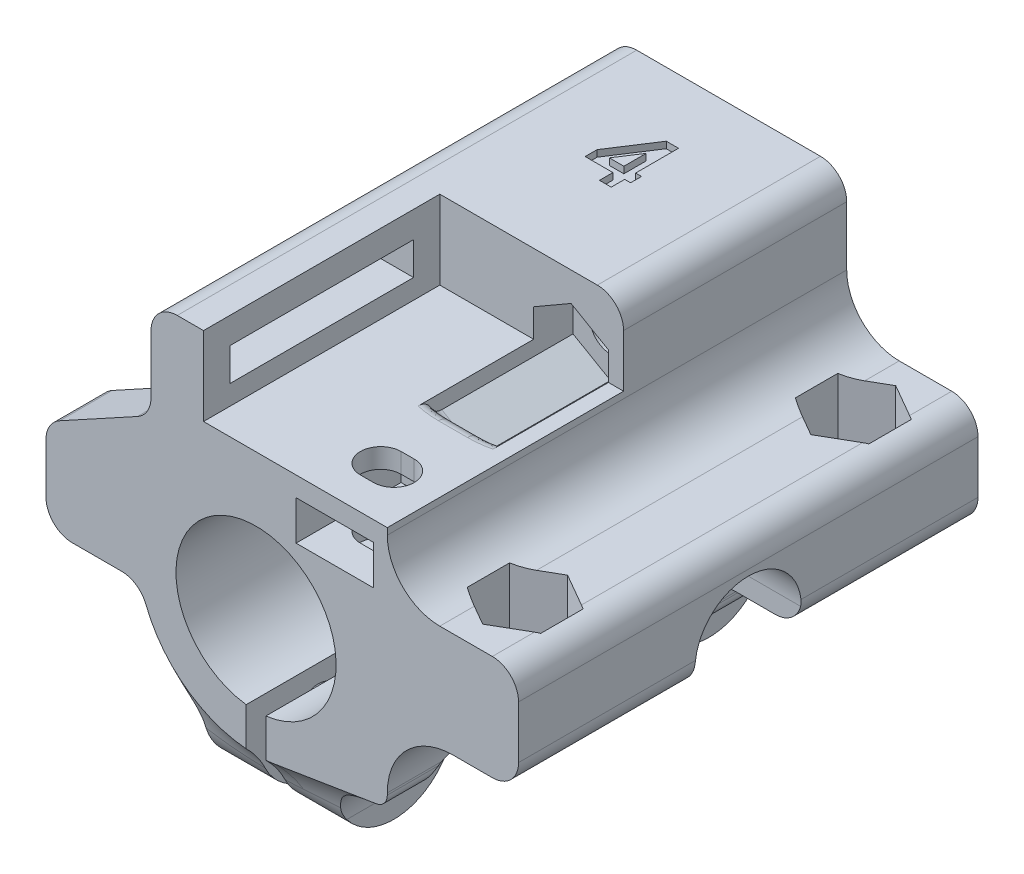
SolidWorks part; units mm, degrees
ref_plane "Спереди" through (0, 0, 0) normal (0, 0, 1) x (1, 0, 0)
ref_plane "Сверху" through (0, 0, 0) normal (0, 1, 0) x (1, 0, 0)
ref_plane "Справа" through (0, 0, 0) normal (1, 0, 0) x (0, 0, -1)
sketch "Эскиз1" plane through (0, 0, 0) normal (0, 0, 1) x (1, 0, 0)
  line L0 (0, 0) -> (0, 21.6321) construction
  line L1 (0, 0) -> (26.3176, 0) construction
  line L2 (10, -1.5) -> (10, -7.5)
  line L3 (-8, 15) -> (-8, 6.0828)
  line L4 (-6, 17) -> (8, 17)
  line L5 (10, 15) -> (10, 6.5)
  line L6 (10, -7.5) -> (1.4365, -8.8846)
  line L8 (10, 6.5) -> (18, 6.5)
  line L9 (20, 4.5) -> (20, 0.5)
  line L10 (18, -1.5) -> (10, -1.5)
  arc A0 (-8.5263, 2.8813) -> (-8, 6.0828) centre (-18, 6.0828) ccw
  arc A1 (-8.5263, 2.8813) -> (1.4365, -8.8846) centre (0, 0) ccw
  arc A2 (20, 0.5) -> (18, -1.5) centre (18, 0.5) cw
  arc A3 (18, 6.5) -> (20, 4.5) centre (18, 4.5) cw
  arc A6 (8, 17) -> (10, 15) centre (8, 15) cw
  arc A7 (-6, 17) -> (-8, 15) centre (-6, 15) ccw
  point P16 (20, 6.5)
  point P30 (20, -1.5)
  dimension "D2" = 1.5
  dimension "D4" = 2
  dimension "D5" = 6
  dimension "D6" = 9
  dimension "D12" = 2
  dimension "D13" = 10
  dimension "D3" = 20
  dimension "D7" = 17
  dimension "D8" = 8
  dimension "D9" = 10
  dimension "D14" = 8
extrude "Бобышка-Вытянуть1" add sketch "Эскиз1" along normal blind 35
fillet "Скругление21" radius 5 1 edges at (10, -1.5, 17.5)
fillet "Скругление24" radius 4 1 edges at (10, 6.5, 17.5)
sketch "Эскиз2" plane through (20, 0, 0) normal (1, 0, 0) x (0, 0, -1)
  line L1 (-35, 0.5) -> (-35, -1.5) construction
  line L3 (-21.55, 0) -> (-21.55, -7.076)
  line L5 (0, 0) -> (-35, 0) construction
  line L8 (-21.55, -7.076) -> (-13.45, -7.076)
  line L9 (-13.45, -7.076) -> (-13.45, 0)
  arc A0 (-13.45, 0) -> (-21.55, 0) centre (-17.5, 0) ccw
  dimension "D1" = 8.1
extrude "Вырез-Вытянуть1" cut sketch "Эскиз2" against normal blind 10
sketch "Эскиз3" plane through (0, 0, 35) normal (0, 0, 1) x (1, 0, 0)
  line L0 (10, 15) -> (10, 11)
  line L3 (10, 11) -> (-4, 11)
  line L4 (-4, 17) -> (-4, 11)
  line L5 (8, 17) -> (-6, 17) construction
  line L6 (-4, 17) -> (8, 17)
  line L7 (10, 10.5) -> (10, 15) construction
  line L10 (0, 0) -> (0, 11.8) construction
  arc A1 (10, 15) -> (8, 17) centre (8, 15) ccw construction
  arc A2 (10, 15) -> (8, 17) centre (8, 15) ccw
  dimension "D1" = 14
  dimension "D3" = 11
extrude "Вырез-Вытянуть2" cut sketch "Эскиз3" against normal blind 18
sketch "Эскиз5" plane through (0, 0, 0) normal (0, 0, -1) x (-1, 0, 0)
  line L0 (0, 0) -> (0, 21.6564) construction
  line L1 (-7.2, 15.7) -> (3.6, 15.7)
  line L2 (-8.2, 14.7) -> (-8.2, 8.3)
  line L3 (-7.2, 7.3) -> (3.6, 7.3)
  line L4 (4.6, 14.7) -> (4.6, 8.3)
  line L6 (-8.2, 11.5) -> (4.6, 11.5) construction
  arc A0 (3.6, 15.7) -> (4.6, 14.7) centre (3.6, 14.7) cw
  arc A1 (3.6, 7.3) -> (4.6, 8.3) centre (3.6, 8.3) ccw
  arc A2 (-8.2, 8.3) -> (-7.2, 7.3) centre (-7.2, 8.3) ccw
  arc A3 (-7.2, 15.7) -> (-8.2, 14.7) centre (-7.2, 14.7) ccw
  point P6 (4.6, 15.7)
  point P13 (-8.2, 15.7)
  dimension "D2" = 1
  dimension "D1" = 12.8
  dimension "D3" = 8.4
  dimension "D4" = 11.5
  dimension "D5" = 8.2
extrude "Вырез-Вытянуть4" cut sketch "Эскиз5" against normal blind 12
fillet "Скругление22" radius 1 1 edges at (10, -7.5, 17.5)
ref_plane "Плоскость2" [suppressed] through (0, 0, 25) normal (0, 0, 1) x (1, 0, 0)
sketch "Эскиз6" plane through (0, 0, 25) normal (0, 0, -1) x (-1, 0, 0)
  line L0 (-7, 11.5) -> (4.6, 11.5) construction
  line L2 (4.6, 8.3) -> (4.6, 14.7) construction
  line L3 (0, 0) -> (0, 20.3496) construction
  circle A0 centre (-6, 11.5) radius 1.55
  dimension "D1" = 3.1
  dimension "D2" = 6
extrude "Вырез-Вытянуть5" cut sketch "Эскиз6" along normal through all
sketch "Эскиз7" plane through (0, 0, 25) normal (0, 0, 1) x (1, 0, 0)
  line L1 (6, 8.2091) -> (8.85, 9.8546)
  line L2 (8.85, 9.8546) -> (8.85, 13.1454)
  line L3 (8.85, 13.1454) -> (6, 14.7909)
  line L4 (6, 14.7909) -> (3.15, 13.1454)
  line L5 (3.15, 13.1454) -> (3.15, 9.8546)
  line L6 (3.15, 9.8546) -> (6, 8.2091)
  circle A0 centre (6, 11.5) radius 2.85 construction
  dimension "D1" = 5.7
extrude "Вырез-Вытянуть6" cut sketch "Эскиз7" against normal blind 11
sketch "Эскиз9" plane through (0, 17, 0) normal (0, 1, 0) x (1, 0, 0)
  line L0 (-6, -17.5) -> (20, -17.5) construction
  line L1 (8, 0) -> (-6, 0) construction
  line L3 (0, 0) -> (0, -35) construction
  line L4 (-4, -35) -> (-6, -35) construction
  circle A0 centre (15.5, -5) radius 1.55
  circle A1 centre (15.5, -30) radius 1.55
  dimension "D1" = 3.1
  dimension "D3" = 15.5
  dimension "D2" = 25
  dimension "D4" = 17.5
extrude "Вырез-Вытянуть8" cut sketch "Эскиз9" against normal through all
sketch "Эскиз10" plane through (0, 17, 0) normal (0, -1, 0) x (1, 0, 0)
  line L0 (-9, 17.5) -> (23.6847, 17.5) construction
  line L1 (12.7, 28.3834) -> (15.5, 26.7668)
  line L2 (15.5, 26.7668) -> (18.3, 28.3834)
  line L3 (18.3, 28.3834) -> (18.3, 31.6166)
  line L4 (18.3, 31.6166) -> (15.5, 33.2332)
  line L5 (15.5, 33.2332) -> (12.7, 31.6166)
  line L6 (12.7, 31.6166) -> (12.7, 28.3834)
  line L7 (-9, 35) -> (-9, 0) construction
  line L8 (12.7, 3.3834) -> (12.7, 6.6166)
  line L9 (15.5, 1.7668) -> (12.7, 3.3834)
  line L10 (18.3, 3.3834) -> (15.5, 1.7668)
  line L11 (18.3, 6.6166) -> (18.3, 3.3834)
  line L12 (15.5, 8.2332) -> (18.3, 6.6166)
  line L13 (12.7, 6.6166) -> (15.5, 8.2332)
  circle A0 centre (15.5, 30) radius 2.8 construction
  circle A1 centre (15.5, 5) radius 2.8 construction
  dimension "D1" = 5.6
extrude "Вырез-Вытянуть9" cut sketch "Эскиз10" along normal blind 15
sketch "Эскиз13" plane through (0, 0, 0) normal (0, 0, -1) x (-1, 0, 0)
  circle A0 centre (-6, 11.5) radius 2.85
  dimension "D1" = 5.7
extrude "Вырез-Вытянуть10" cut sketch "Эскиз13" against normal up to surface (12 mm away)
fillet "Скругление3" radius 1 2 edges at (8.2, 13.3118, 6) (8.2, 9.6882, 6)
sketch "Эскиз16" plane through (0, 0, 0) normal (1, 0, 0) x (0, 0, -1)
  line L0 (0, 0) -> (-35, 0) construction
  line L1 (-17.5, 0) -> (-17.5, 5.7469) construction
  line L2 (-35, -9) -> (0, -9) construction
  line L4 (-35, 0.5) -> (-35, -1.5) construction
  circle A0 centre (-29.5, -9) radius 1.55 construction
  circle A1 centre (-29.5, -9) radius 4.5
  circle A2 centre (-5.5, -9) radius 4.5
  circle A3 centre (-17.5, 0) radius 4.05 construction
  dimension "D1" = 3.1
  dimension "D2" = 24
  dimension "D3" = 9
extrude "Бобышка-Вытянуть4" add sketch "Эскиз16" along normal mid plane 10
fillet "Скругление7" radius 7 4 edges at (-2.517, -8.6409, 9.9856) (-2.973, -8.4948, 25.0284) (3.2234, -8.5957, 25.0182) (3.2234, -8.5957, 9.9818)
fillet "Скругление9" radius 7 4 edges at (-1.5846, -8.8594, 33.9978) (-2.973, -8.4948, 1.0284) (3.2234, -8.5957, 1.0182) (3.2234, -8.5957, 33.9818)
fillet "Скругление11" radius 5 2 edges at (-5, -7.4833, 26.9178) (-5, -7.4833, 8.0822)
fillet "Скругление23" radius 4 2 edges at (5, -8.3084, 7.5868) (5, -8.3084, 27.4132)
sketch "Эскиз15" plane through (0, 0, 35) normal (0, 0, 1) x (1, 0, 0)
  circle A0 centre (0, 0) radius 6.1
  dimension "D1" = 12.2
extrude "Вырез-Вытянуть11" cut sketch "Эскиз15" against normal through all
sketch "Эскиз18" plane through (0, 0, 35) normal (0, 0, 1) x (1, 0, 0)
  line L0 (-5, -13.5) -> (5, -13.5) construction
  line L1 (-0.75, 0) -> (0.75, 0)
  line L2 (-0.75, 0) -> (-0.75, -13.5)
  line L3 (-0.75, -13.5) -> (0.75, -13.5)
  line L4 (0.75, 0) -> (0.75, -13.5)
  point P6 (0, 0)
  dimension "D1" = 1.5
extrude "Вырез-Вытянуть13" cut sketch "Эскиз18" against normal through all
ref_plane "Плоскость1" through (-10, 0, 0) normal (1, 0, 0) x (0, 0, -1)
sketch "Эскиз17" plane through (20, 0, 0) normal (1, 0, 0) x (0, 0, -1)
  line L0 (-17.5, -8.9687) -> (-17.5, 18.0703) construction
  line L1 (-20.3334, -8.9687) -> (-14.6666, -8.9687) construction
  circle A0 centre (-29.5, -9) radius 1.575
  circle A1 centre (-5.5, -9) radius 1.575
  dimension "D1" = 3.15
extrude "Вырез-Вытянуть12" cut sketch "Эскиз17" against normal through all
sketch "Эскиз19" plane through (-10, 0, 0) normal (1, 0, 0) x (0, 0, -1)
  line L0 (-17.5, -8.9687) -> (-17.5, 18.2144) construction
  line L1 (-32.7332, -9) -> (-31.1166, -11.8)
  line L2 (-31.1166, -11.8) -> (-27.8834, -11.8)
  line L3 (-27.8834, -11.8) -> (-26.2668, -9)
  line L4 (-26.2668, -9) -> (-27.8834, -6.2)
  line L5 (-27.8834, -6.2) -> (-31.1166, -6.2)
  line L6 (-31.1166, -6.2) -> (-32.7332, -9)
  line L7 (-14.6666, -8.9687) -> (-20.3334, -8.9687) construction
  line L8 (-3.8834, -6.2) -> (-2.2668, -9)
  line L9 (-7.1166, -6.2) -> (-3.8834, -6.2)
  line L10 (-8.7332, -9) -> (-7.1166, -6.2)
  line L11 (-7.1166, -11.8) -> (-8.7332, -9)
  line L12 (-3.8834, -11.8) -> (-7.1166, -11.8)
  line L13 (-2.2668, -9) -> (-3.8834, -11.8)
  circle A0 centre (-29.5, -9) radius 2.8 construction
  circle A1 centre (-5.5, -9) radius 2.8 construction
  dimension "D1" = 5.6
extrude "Вырез-Вытянуть14" cut sketch "Эскиз19" along normal blind 7
sketch "Эскиз24" plane through (20, 0, 0) normal (1, 0, 0) x (0, 0, -1)
  circle A0 centre (-29.5, -9) radius 2.85
  circle A1 centre (-5.5, -9) radius 2.85
  dimension "D1" = 5.7
extrude "Вырез-Вытянуть18" cut sketch "Эскиз24" against normal blind 16
sketch "Эскиз27" plane through (-4, 0, 0) normal (1, 0, 0) x (0, 0, -1)
  line L0 (-35, 17) -> (-35, 11) construction
  line L1 (-33, 15) -> (-19, 15)
  line L2 (-33, 15) -> (-33, 12.5)
  line L3 (-33, 12.5) -> (-19, 12.5)
  line L4 (-19, 15) -> (-19, 12.5)
  line L5 (-17, 17) -> (-17, 11) construction
  line L6 (-17, 17) -> (-35, 17) construction
  dimension "D1" = 2
  dimension "D2" = 2
  dimension "D3" = 2
  dimension "D4" = 2.5
sketch "Эскиз28" plane through (0, 0, 35) normal (0, 0, 1) x (1, 0, 0)
  line L0 (6, 11.5) -> (6, -14.6324) construction
  line L1 (-4, 11) -> (10, 11) construction
  line L2 (3.05, 9.5) -> (8.95, 9.5)
  line L3 (3.05, 9.5) -> (3.05, 6.5)
  line L4 (3.05, 6.5) -> (8.95, 6.5)
  line L5 (8.95, 9.5) -> (8.95, 6.5)
  point P7 (6, 9.5)
  dimension "D1" = 5.9
  dimension "D2" = 3
  dimension "D3" = 1.5
extrude "Вырез-Вытянуть20" cut sketch "Эскиз28" against normal blind 8
sketch "Эскиз29" plane through (0, 11, 0) normal (0, 1, 0) x (1, 0, 0)
  line L0 (6, -17) -> (6, -37.7365) construction
  line L1 (6, -14) -> (6, -25) construction
  line L2 (8, -17) -> (-4, -17) construction
  line L4 (5.5, -31) -> (6.5, -31) construction
  line L5 (5.5, -29.45) -> (6.5, -29.45)
  line L6 (5.5, -32.55) -> (6.5, -32.55)
  line L7 (-4, -35) -> (10, -35) construction
  arc A1 (5.5, -29.45) -> (5.5, -32.55) centre (5.5, -31) ccw
  arc A2 (6.5, -32.55) -> (6.5, -29.45) centre (6.5, -31) ccw
  point P12 (6, -31)
  dimension "D1" = 4
  dimension "D2" = 1.55
  dimension "D3" = 1
extrude "Вырез-Вытянуть21" cut sketch "Эскиз29" against normal blind 6
extrude "Вырез-Вытянуть22" cut sketch "Эскиз27" against normal blind 3
fillet "Скругление17" radius 1 2 edges at (7.425, 9.0318, 25) (4.575, 9.0318, 25)
fillet "Скругление18" radius 1 3 edges at (3.158, 11, 25) (8.842, 11, 25) (6, 11, 25)
sketch "Эскиз31" plane through (0, 0, 35) normal (0, 0, 1) x (1, 0, 0)
  line L0 (-16, 5) -> (-8, 9.381)
  line L3 (-8, 9.381) -> (-8, -2)
  line L4 (-16, -2) -> (-8, -2)
  line L5 (-16, -2) -> (-16, 5)
  line L6 (0, 18.1949) -> (0, 0) construction
  line L7 (0, 0) -> (-27.1426, 0) construction
  line L9 (-8, 15) -> (-8, 6.0828) construction
  dimension "D1" = 7
  dimension "D2" = 16
  dimension "D3" = 2
extrude "Бобышка-Вытянуть9" add sketch "Эскиз31" against normal blind 4
fillet "Скругление20" radius 2 7 edges at (-8.9883, 0.4579, 31) (-8, 7.7319, 31) (-8.1325, 4.4605, 31) (-8.775, -2, 33) (-16, -2, 33) (-16, 5, 33) (-8, 9.381, 33)
sketch "Эскиз32" plane through (0, 17, 0) normal (0, 1, 0) x (1, 0, 0)
  text T0 "<b>4</b>" font "Century Gothic" height 5
extrude "Вырез-Вытянуть23" cut sketch "Эскиз32" against normal blind 0.5
